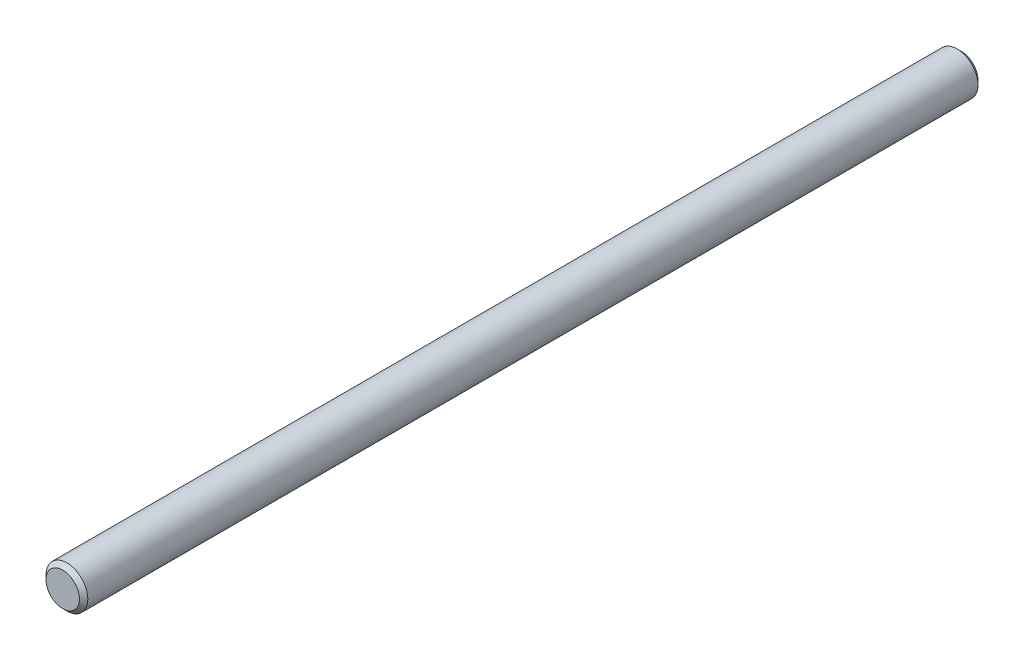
SolidWorks part; units mm, degrees
ref_plane "Plan1" through (0, 0, 0) normal (0, 0, 1) x (1, 0, 0)
ref_plane "Plan2" through (0, 0, 0) normal (0, 1, 0) x (1, 0, 0)
ref_plane "Plan3" through (0, 0, 0) normal (1, 0, 0) x (0, 0, -1)
sketch "Esquisse2" plane through (0, 0, 0) normal (0, 0, 1) x (1, 0, 0)
  circle A0 centre (0, 0) radius 1
  dimension "D1" = 2
extrude "Base" add sketch "Esquisse2" along normal mid plane 43
chamfer "Chanfreins" distance 0.2 angle 45 2 edges at (1, 0, -21.5) (1, 0, 21.5)
